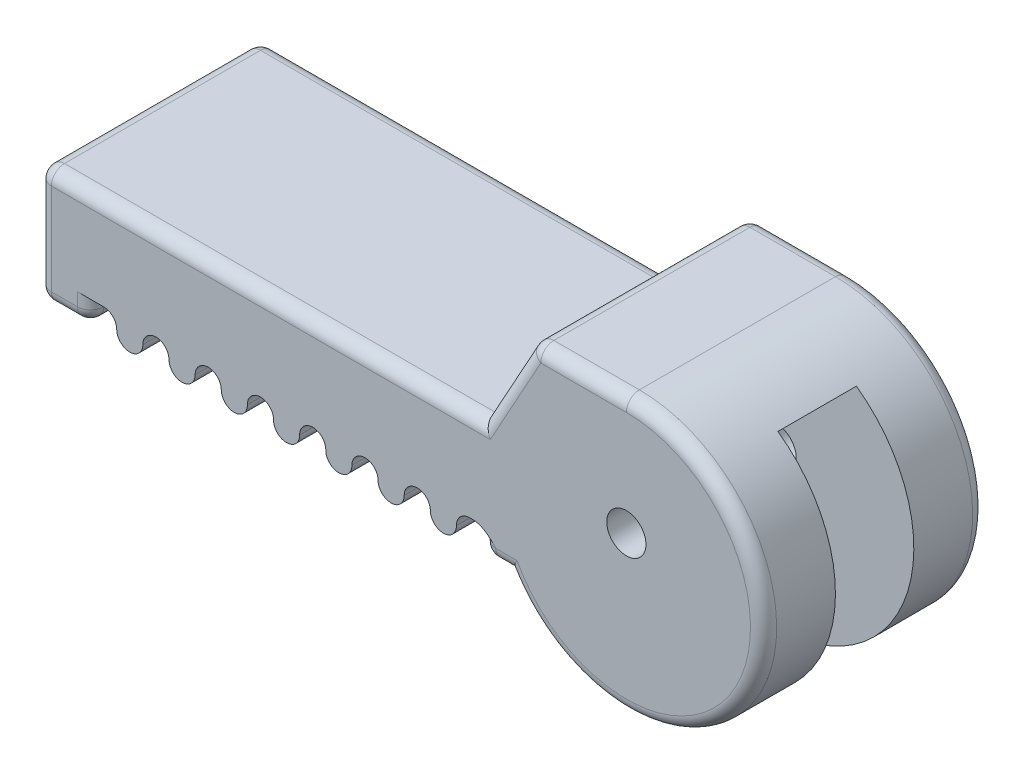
SolidWorks part; units mm, degrees
ref_plane "Plane1" through (0, 0, 0) normal (0, 0, 1) x (1, 0, 0)
ref_plane "Plane2" through (0, 0, 0) normal (0, 1, 0) x (1, 0, 0)
ref_plane "Plane3" through (0, 0, 0) normal (1, 0, 0) x (0, 0, -1)
sketch "Esquisse1" plane through (0, 0, 0) normal (0, 0, 1) x (1, 0, 0)
  line L0 (-45, 3.5) -> (-11, 3.5)
  line L1 (-45, 3.5) -> (-45, -5.5)
  line L2 (-45, -5.5) -> (-41, -5.5)
  line L3 (-11, 3.5) -> (-7.1355, 10.5)
  line L4 (0, 10.5) -> (-7.1355, 10.5)
  line L5 (-41, -5.5) -> (-41, -3.5)
  line L6 (-41, -3.5) -> (-39, -3.5)
  line L7 (-39, -3.5) -> (-39, -5.5)
  line L8 (-39, -5.5) -> (-37, -5.5)
  line L10 (-37, -5.5) -> (-37, -3.5)
  line L11 (-37, -3.5) -> (-35, -3.5)
  line L12 (-35, -3.5) -> (-35, -5.5)
  line L13 (-35, -5.5) -> (-33, -5.5)
  line L15 (-27, -5.5) -> (-27, -3.4774)
  line L16 (-27, -3.4774) -> (-29, -3.4774)
  line L17 (-29, -3.4774) -> (-29, -5.5)
  line L18 (-31, -5.5) -> (-31, -3.5)
  line L19 (-31, -3.5) -> (-33, -3.5)
  line L20 (-33, -3.5) -> (-33, -5.5)
  line L21 (-31, -5.5) -> (-29, -5.5)
  line L22 (-27, -5.5) -> (-25, -5.5)
  line L23 (-11, -5.5) -> (-11, -3.4774)
  line L24 (-11, -3.4774) -> (-13, -3.4774)
  line L25 (-13, -3.4774) -> (-13, -5.5)
  line L26 (-15, -5.5) -> (-15, -3.5)
  line L27 (-15, -3.5) -> (-17, -3.5)
  line L28 (-17, -3.5) -> (-17, -5.5)
  line L29 (-19, -3.5) -> (-19, -5.5)
  line L30 (-21, -3.5) -> (-19, -3.5)
  line L31 (-21, -5.5) -> (-21, -3.5)
  line L32 (-23, -3.4774) -> (-23, -5.5)
  line L33 (-25, -3.4774) -> (-23, -3.4774)
  line L34 (-25, -5.5) -> (-25, -3.4774)
  line L35 (-23, -5.5) -> (-21, -5.5)
  line L36 (-19, -5.5) -> (-17, -5.5)
  line L37 (-15, -5.5) -> (-13, -5.5)
  line L38 (-11, -5.5) -> (-8.9443, -5.5)
  arc A1 (-8.9443, -5.5) -> (0, 10.5) centre (0, 0) ccw
  dimension "D1" = 2
  dimension "D2" = 45
  dimension "D6" = 4
  dimension "D7" = 2
  dimension "D9" = 2
  dimension "D10" = 2
extrude "Base-Extrusion" add sketch "Esquisse1" along normal blind 17
fillet "Congé1" radius 1
fillet "Congé2" radius 1
fillet "Congé3" radius 1
fillet "Congé4" radius 1
sketch "Esquisse2" plane through (0, -5.5, 0) normal (0, -1, 0) x (1, 0, 0)
  line L0 (-10, 14) -> (-41, 14)
  line L1 (-10, 14) -> (-10, 3)
  line L2 (-10, 3) -> (-41, 3)
  line L3 (-41, 14) -> (-41, 3)
  line L6 (-41, 16) -> (-41, 1) construction
  line L7 (-45, 1) -> (-45, 16) construction
  dimension "D3" = 4
extrude "Enlèv. mat.-Extru.1" cut sketch "Esquisse2" against normal blind 3.5
fillet "Congé5" radius 1
fillet "Congé9" radius 1
fillet "Congé10" radius 1
fillet "Congé11" radius 1
fillet "Congé13" radius 1
fillet "Congé14" radius 1
fillet "Congé15" radius 1
fillet "Congé16" radius 1
fillet "Congé17" radius 1
fillet "Congé20" radius 1
fillet "Congé21" radius 1
fillet "Congé22" radius 1
fillet "Congé23" radius 1
fillet "Congé24" radius 1
fillet "Congé25" radius 1
sketch "Esquisse3" plane through (0, 0, 17) normal (0, 0, 1) x (1, 0, 0)
  line L1 (-44, 3.5) -> (-11, 3.5) construction
  circle A0 centre (0, 1.5) radius 1.5
  dimension "D1" = 3
  dimension "D2" = 2
extrude "Enlèv. mat.-Extru.2" cut sketch "Esquisse3" against normal blind 33.5
ref_plane "Plan4" through (0, 0, 11.5) normal (0, 0, 1) x (1, 0, 0)
sketch "Esquisse7" plane through (0, 0, 11.5) normal (0, 0, 1) x (1, 0, 0)
  line L0 (3.9377, 7.9112) -> (9.3639, 9.5)
  line L1 (9.3639, 9.5) -> (14.9049, -9.4236)
  line L2 (-4.5397, -4.5) -> (-8.9443, -13.3492)
  line L3 (-8.9443, -13.3492) -> (14.9049, -9.4236)
  arc A0 (3.9377, 7.9112) -> (-4.5397, -4.5) centre (0, 1.5) ccw
extrude "Enlèv. mat.-Extru.3" cut sketch "Esquisse7" against normal blind 6
